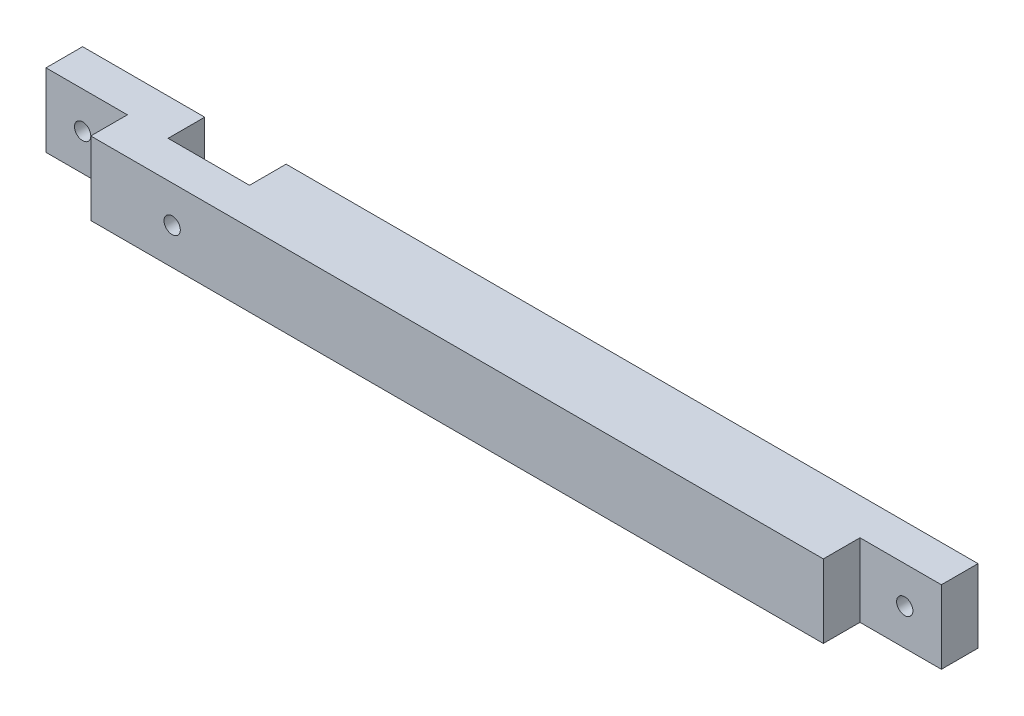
SolidWorks part; units mm, degrees
ref_plane "Face" through (0, 0, 0) normal (0, 0, 1) x (1, 0, 0)
ref_plane "Dessus" through (0, 0, 0) normal (0, 1, 0) x (1, 0, 0)
ref_plane "Droite" through (0, 0, 0) normal (1, 0, 0) x (0, 0, -1)
sketch "Esquisse1" plane through (0, 0, 0) normal (0, 0, 1) x (1, 0, 0)
  line L1 (-67.2717, -109.6176) -> (42.7283, -109.6176)
  line L2 (-67.2717, -109.6176) -> (-67.2717, -100.6176)
  line L3 (-67.2717, -100.6176) -> (42.7283, -100.6176)
  line L4 (42.7283, -109.6176) -> (42.7283, -100.6176)
  dimension "D1" = 110
  dimension "D2" = 9
extrude "Extrusion1" add sketch "Esquisse1" along normal blind 9
sketch "Esquisse2" plane through (0, 0, 9) normal (0, 0, 1) x (1, 0, 0)
  line L0 (42.7283, -100.6176) -> (-67.2717, -100.6176) construction
  line L1 (-67.2717, -109.6176) -> (-57.2717, -109.6176)
  line L2 (-67.2717, -109.6176) -> (-67.2717, -100.6176)
  line L3 (-67.2717, -100.6176) -> (-57.2717, -100.6176)
  line L4 (-57.2717, -109.6176) -> (-57.2717, -100.6176)
  line L6 (42.7283, -109.6176) -> (32.7283, -109.6176)
  line L7 (42.7283, -109.6176) -> (42.7283, -100.6176)
  line L8 (42.7283, -100.6176) -> (32.7283, -100.6176)
  line L9 (32.7283, -109.6176) -> (32.7283, -100.6176)
  dimension "D1" = 10
  dimension "D2" = 10
extrude "Enlèv. mat.-Extru.1" cut sketch "Esquisse2" against normal blind 4.5
sketch "Esquisse4" plane through (0, 0, 4.5) normal (0, 0, 1) x (1, 0, 0)
  line L0 (42.7283, -109.6176) -> (42.7283, -100.6176) construction
  line L1 (32.7283, -109.6176) -> (42.7283, -109.6176) construction
  circle A0 centre (38.2284, -105.1454) radius 1
  point P2 (42.7283, -105.1176)
  point P5 (37.7283, -109.6176)
  dimension "D3" = 2
  dimension "D1" = 4.5
  dimension "D2" = 4.5
extrude "Enlèv. mat.-Extru.2" cut sketch "Esquisse4" against normal blind 4.5
sketch "Esquisse5" plane through (0, 0, 4.5) normal (0, 0, 1) x (1, 0, 0)
  line L0 (-67.2717, -109.6176) -> (-57.2717, -109.6176) construction
  line L1 (-67.2717, -100.6176) -> (-67.2717, -109.6176) construction
  circle A0 centre (-62.7717, -105.1176) radius 1
  dimension "D1" = 2
  dimension "D2" = 4.5
  dimension "D3" = 4.5
extrude "Enlèv. mat.-Extru.3" cut sketch "Esquisse5" against normal blind 4.5
sketch "Esquisse6" plane through (0, 0, 0) normal (0, 0, -1) x (-1, 0, 0)
  line L0 (-42.7283, -100.6176) -> (67.2717, -100.6176) construction
  line L1 (52.2717, -100.6176) -> (42.2717, -100.6176)
  line L2 (52.2717, -100.6176) -> (52.2717, -109.6176)
  line L3 (52.2717, -109.6176) -> (42.2717, -109.6176)
  line L4 (42.2717, -100.6176) -> (42.2717, -109.6176)
  line L5 (67.2717, -109.6176) -> (-42.7283, -109.6176) construction
  dimension "D1" = 10
  dimension "D2" = 15
extrude "Enlèv. mat.-Extru.4" cut sketch "Esquisse6" against normal blind 4.5
sketch "Esquisse7" plane through (0, 0, 4.5) normal (0, 0, -1) x (-1, 0, 0)
  line L0 (52.2717, -100.6176) -> (42.2717, -109.6176) construction
  line L1 (42.2717, -109.6176) -> (42.2717, -100.6176) construction
  line L2 (42.2717, -100.6176) -> (52.2717, -109.6176) construction
  circle A0 centre (47.2717, -105.1176) radius 1
  dimension "D1" = 2
extrude "Enlèv. mat.-Extru.5" cut sketch "Esquisse7" against normal blind 4.5
